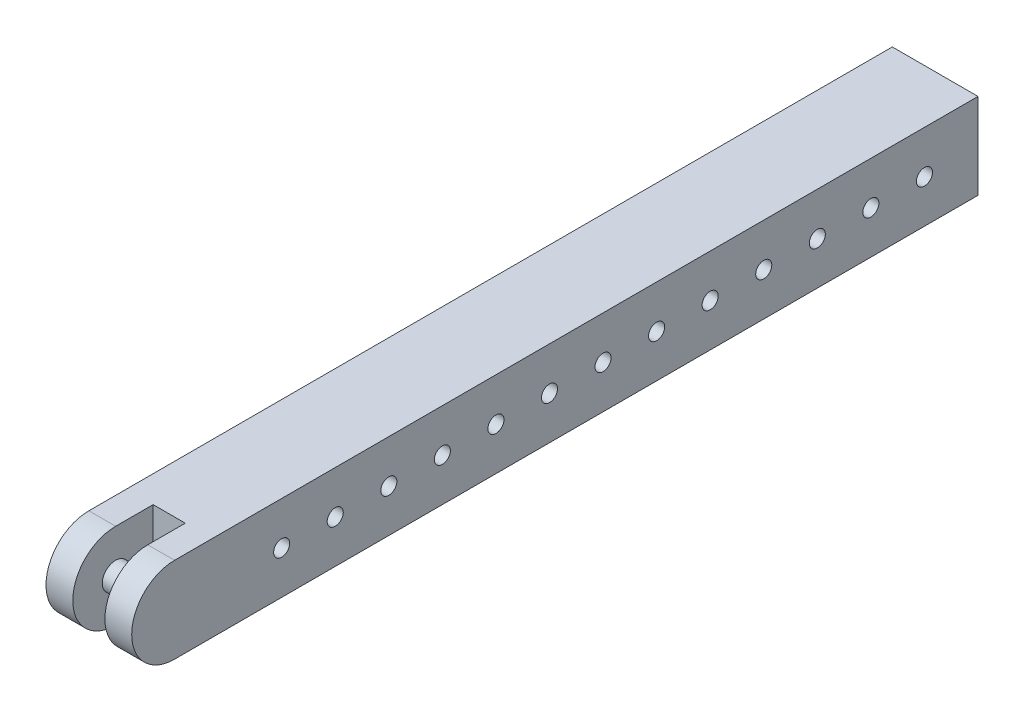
SolidWorks part; units mm, degrees
ref_plane "Plan de face" through (0, 0, 0) normal (0, 0, 1) x (1, 0, 0)
ref_plane "Plan de dessus" through (0, 0, 0) normal (0, 1, 0) x (1, 0, 0)
ref_plane "Plan de droite" through (0, 0, 0) normal (1, 0, 0) x (0, 0, -1)
sketch "Esquisse1" plane through (0, 0, 0) normal (0, 0, 1) x (1, 0, 0)
  line L1 (0, 0) -> (-16, 0)
  line L2 (0, 0) -> (0, 16)
  line L3 (0, 16) -> (-16, 16)
  line L4 (-16, 0) -> (-16, 16)
  dimension "D1" = 16
  dimension "D2" = 16
extrude "Boss.-Extru.1" add sketch "Esquisse1" along normal blind 150 contours L3 L4 L1 L2
sketch "Esquisse2" plane through (0, 0, 0) normal (1, 0, 0) x (0, 0, -1)
  line L0 (-150, 0) -> (-150, 16) construction
  circle A0 centre (-150, 8) radius 8
extrude "Boss.-Extru.2" add sketch "Esquisse2" against normal up to surface (16 mm away) contours A0
sketch "Esquisse3" plane through (0, 0, 0) normal (0, -1, 0) x (1, 0, 0)
  line L0 (-16, 150) -> (-16, 0) construction
  line L1 (-11, 163.4259) -> (-5, 163.4259)
  line L2 (-11, 163.4259) -> (-11, 143)
  line L3 (-11, 143) -> (-5, 143)
  line L4 (-5, 163.4259) -> (-5, 143)
  line L5 (0, 150) -> (0, 0) construction
  line L7 (0, 0) -> (-16, 0) construction
  point P10 (-8, 0)
  dimension "D1" = 5
  dimension "D2" = 5
  dimension "D3" = 143
extrude "Enlèv. mat.-Extru.1" cut sketch "Esquisse3" against normal through all contours L1 L4 L3 L2
sketch "Esquisse4" plane through (0, 0, 0) normal (1, 0, 0) x (0, 0, -1)
  circle A0 centre (-150, 8) radius 2.5
  arc A1 (-150, 16) -> (-150, 0) centre (-150, 8) ccw construction
  dimension "D1" = 5
extrude "Boss.-Extru.3" add sketch "Esquisse4" against normal up to surface (16 mm away) contours A0
sketch "Esquisse5" plane through (0, 0, 0) normal (1, 0, 0) x (0, 0, -1)
  line L0 (-150, 0) -> (0, 0) construction
  circle A0 centre (-130, 8) radius 1.5
  arc A1 (-150, 16) -> (-150, 0) centre (-150, 8) ccw construction
  circle A2 centre (-120, 8) radius 1.5
  circle A3 centre (-110, 8) radius 1.5
  circle A4 centre (-100, 8) radius 1.5
  circle A5 centre (-90, 8) radius 1.5
  circle A6 centre (-80, 8) radius 1.5
  circle A7 centre (-70, 8) radius 1.5
  circle A8 centre (-60, 8) radius 1.5
  circle A9 centre (-50, 8) radius 1.5
  circle A10 centre (-40, 8) radius 1.5
  circle A11 centre (-30, 8) radius 1.5
  circle A12 centre (-20, 8) radius 1.5
  circle A13 centre (-10, 8) radius 1.5
  dimension "D1" = 3
  dimension "D3" = 20
  dimension "D2" = 8
  dimension "D4" = 13
extrude "Enlèv. mat.-Extru.2" cut sketch "Esquisse5" against normal through all
